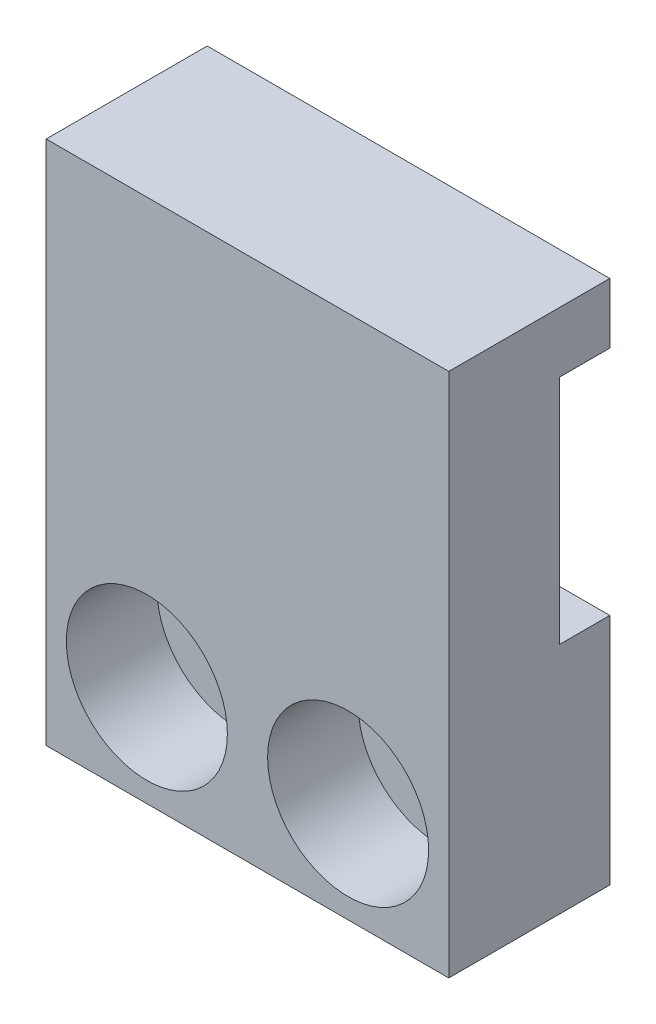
SolidWorks part; units mm, degrees
ref_plane "前视基准面" through (0, 0, 0) normal (0, 0, 1) x (1, 0, 0)
ref_plane "上视基准面" through (0, 0, 0) normal (0, 1, 0) x (1, 0, 0)
ref_plane "右视基准面" through (0, 0, 0) normal (1, 0, 0) x (0, 0, -1)
sketch "草图1" plane through (0, 0, 0) normal (0, 0, 1) x (1, 0, 0)
  line L0 (0, 0) -> (20, 0)
  line L1 (0, 26.1) -> (20, 26.1)
  line L2 (20, 0) -> (20, 26.1)
  line L3 (0, 0) -> (0, 26.1)
  circle A0 centre (5, 5) radius 2.25
  circle A1 centre (15, 5) radius 2.25
extrude "凸台-拉伸1" add sketch "草图1" along normal blind 8
sketch "草图2" plane through (0, 0, 8) normal (0, 0, 1) x (1, 0, 0)
  circle A0 centre (5, 5) radius 4
  circle A1 centre (15, 5) radius 4
extrude "切除-拉伸1" cut sketch "草图2" against normal blind 4.5
sketch "草图3" plane through (20, 0, 0) normal (1, 0, 0) x (0, 0, -1)
  line L0 (-2.5, 11.6) -> (-2.5, 23.1)
  line L1 (-2.5, 11.6) -> (0, 11.6)
  line L2 (-2.5, 23.1) -> (0, 23.1)
extrude "切除-拉伸2" cut sketch "草图3" against normal through all and the other way through all flip side to cut
